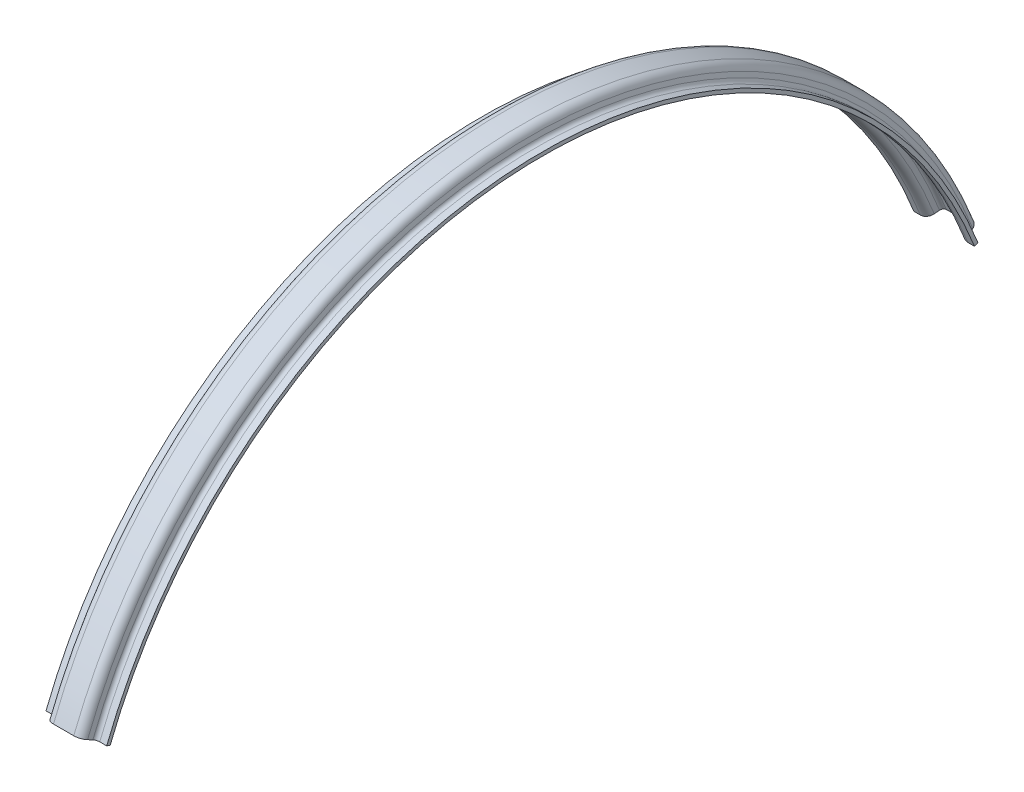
SolidWorks part; units mm, degrees
ref_plane "FRONT" through (0, 0, 0) normal (0, 0, 1) x (1, 0, 0)
ref_plane "TOP" through (0, 0, 0) normal (0, 1, 0) x (1, 0, 0)
ref_plane "SIDE" through (0, 0, 0) normal (1, 0, 0) x (0, 0, -1)
sketch "Sketch2" plane through (0, 0, 0) normal (0, 0, 1) x (1, 0, 0)
  line L0 (-5.5567, 264.287) -> (5.5567, 264.287)
  line L1 (-5.7516, 262.255) -> (5.7516, 262.255)
  line L2 (12.8336, 256.7686) -> (16.637, 256.7686)
  line L3 (0, 47.2956) -> (0, -47.2956) construction
  line L4 (13.0285, 254.7366) -> (16.637, 254.7366)
  line L5 (7.9597, 260.5607) -> (8.6123, 258.1253)
  line L6 (9.9729, 260.8983) -> (10.6255, 258.4629)
  line L7 (16.637, 256.7686) -> (16.637, 254.7366)
  line L8 (-16.637, 256.7686) -> (-16.637, 254.7366)
  line L9 (-9.9729, 260.8983) -> (-10.6255, 258.4629)
  line L10 (-7.9597, 260.5607) -> (-8.6123, 258.1253)
  line L11 (-13.0285, 254.7366) -> (-16.637, 254.7366)
  line L12 (-12.8336, 256.7686) -> (-16.637, 256.7686)
  line L30 (82.8735, 0) -> (-82.8735, 0) construction
  arc A0 (9.9729, 260.8983) -> (5.5567, 264.287) centre (5.5567, 259.715) ccw
  arc A1 (-9.9729, 260.8983) -> (-5.5567, 264.287) centre (-5.5567, 259.715) cw
  arc A2 (13.0285, 254.7366) -> (8.6123, 258.1253) centre (13.0285, 259.3086) cw
  arc A3 (-13.0285, 254.7366) -> (-8.6123, 258.1253) centre (-13.0285, 259.3086) ccw
  arc A4 (-12.8336, 256.7686) -> (-10.6255, 258.4629) centre (-12.8336, 259.0546) ccw
  arc A5 (-5.7516, 262.255) -> (-7.9597, 260.5607) centre (-5.7516, 259.969) ccw
  arc A6 (7.9597, 260.5607) -> (5.7516, 262.255) centre (5.7516, 259.969) ccw
  arc A7 (12.8336, 256.7686) -> (10.6255, 258.4629) centre (12.8336, 259.0546) cw
  point P0 (0, 264.287)
  point P17 (0, 262.255)
  point P19 (9.0649, 264.287)
  point P22 (-9.0649, 264.287)
  point P26 (9.5202, 254.7366)
  point P29 (-9.5202, 254.7366)
  point P32 (-11.0795, 256.7686)
  point P35 (-7.5057, 262.255)
  point P38 (7.5057, 262.255)
  point P41 (11.0795, 256.7686)
  dimension "D7" = 33.274
  dimension "D8" = 4.572
  dimension "D9" = 2.286
  dimension "D1" = 2.032
  dimension "D2" = 2.032
  dimension "D3" = 2.032
  dimension "D4" = 15
  dimension "D5" = 7.5184
  dimension "D6" = 15.0114
  dimension "D10" = 262.255
revolve "Base-Revolve" add sketch "Sketch2" angle 137 mid plane about L30
